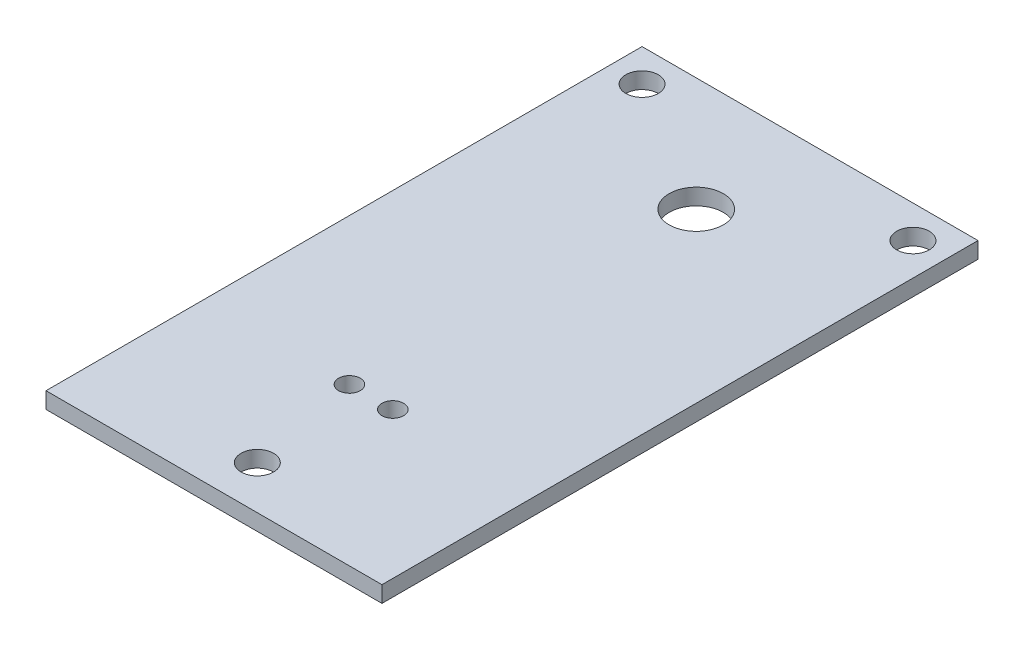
SolidWorks part; units mm, degrees
ref_plane "Front" through (0, 0, 0) normal (0, 0, 1) x (1, 0, 0)
ref_plane "Top" through (0, 0, 0) normal (0, 1, 0) x (1, 0, 0)
ref_plane "Right" through (0, 0, 0) normal (1, 0, 0) x (0, 0, -1)
sketch "Sketch1" plane through (0, 0, 0) normal (0, 1, 0) x (1, 0, 0)
  line L1 (0, 0) -> (62, 0)
  line L2 (0, 0) -> (0, 110)
  line L3 (0, 110) -> (62, 110)
  line L4 (62, 0) -> (62, 110)
  circle A0 centre (6, 104) radius 3
  circle A1 centre (56, 104) radius 3
  circle A2 centre (27, 29) radius 2
  circle A3 centre (35, 29) radius 2
  circle A4 centre (31, 8) radius 3
  circle A5 centre (31, 89) radius 5
extrude "Extrude1" add sketch "Sketch1" along normal blind 3
